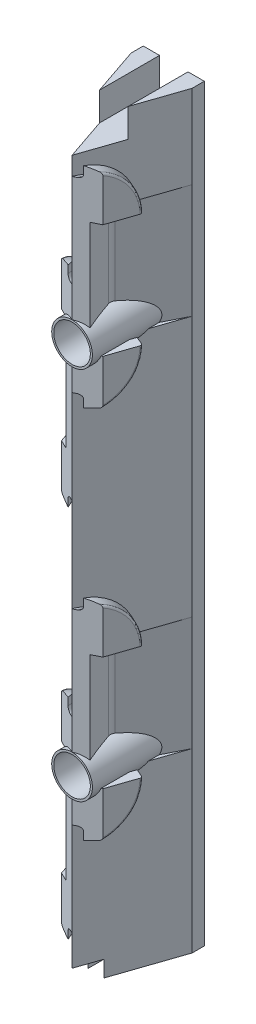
SolidWorks part; units mm, degrees
ref_plane "Plan de face" through (0, 0, 0) normal (0, 0, 1) x (1, 0, 0)
ref_plane "Plan de dessus" through (0, 0, 0) normal (0, 1, 0) x (1, 0, 0)
ref_plane "Plan de droite" through (0, 0, 0) normal (1, 0, 0) x (0, 0, -1)
body saved out of another part "Stock-basBarette-1"
sketch "Esquisse1" plane through (0, 0, -3) normal (0, 0, -1) x (-1, 0, 0)
  line L0 (7.5, -119.9983) -> (-7.5, -119.9983) construction
  line L1 (-3.5, -119.9983) -> (3.5, -119.9983)
  line L2 (-3.5, -119.9983) -> (-3.5, -126.9983)
  line L3 (-3.5, -126.9983) -> (3.5, -126.9983)
  line L4 (3.5, -119.9983) -> (3.5, -126.9983)
  line L5 (-7.5, -119.9983) -> (-7.5, -303.9983) construction
  line L6 (7.5, -303.9983) -> (-7.5, -303.9983) construction
  line L7 (-2, -303.9983) -> (2, -303.9983)
  line L8 (-2, -303.9983) -> (-2, -299.9983)
  line L9 (-2, -299.9983) -> (2, -299.9983)
  line L10 (2, -303.9983) -> (2, -299.9983)
  point P6 (0, -126.9983)
  point P15 (0, -299.9983)
  dimension "D1" = 7
  dimension "D2" = 7
  dimension "D3" = 7.5
  dimension "D4" = 4
  dimension "D5" = 4
  dimension "D6" = 7.5
extrude "Enlèv. mat.-Extru.1" cut sketch "Esquisse1" against normal through all
sketch "Esquisse2" plane through (0, 0, -3) normal (0, 0, -1) x (-1, 0, 0)
sketch_block_instance "Bloc1-1"
sketch_block "Bloc1"
extrude "Enlèv. mat.-Extru.2" cut sketch "Esquisse2" against normal blind 1.5
